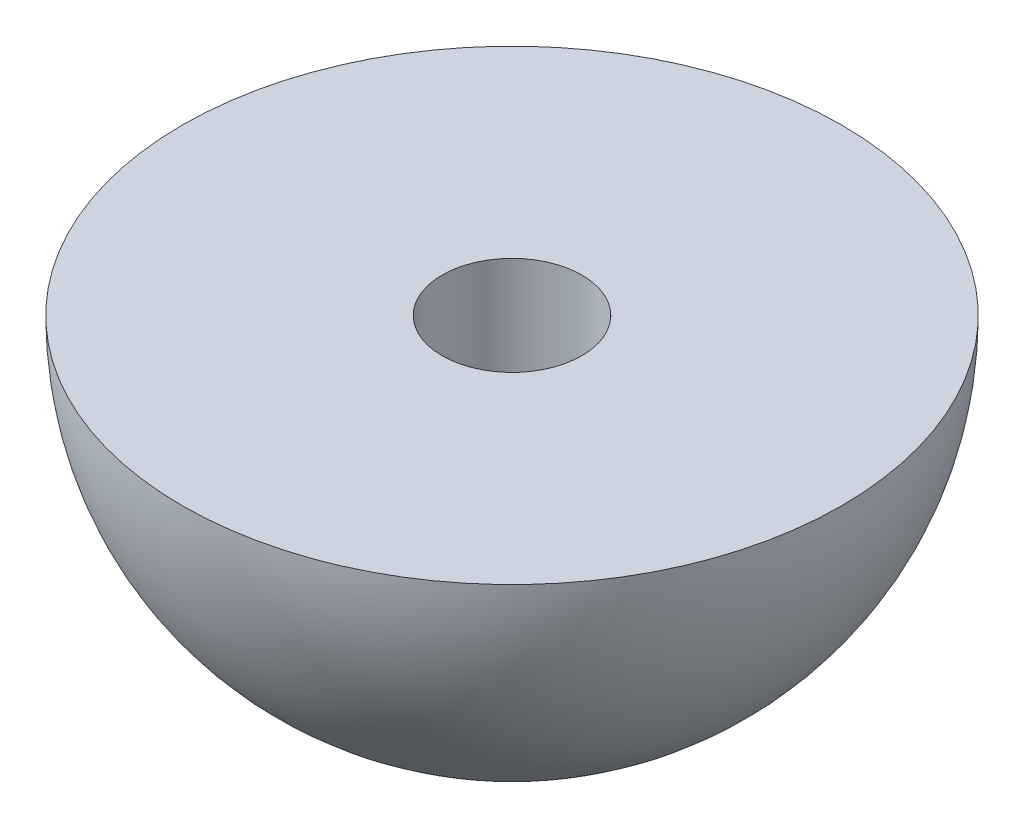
SolidWorks part; units mm, degrees
ref_plane "Front" through (0, 0, 0) normal (0, 0, 1) x (1, 0, 0)
ref_plane "Top" through (0, 0, 0) normal (0, 1, 0) x (1, 0, 0)
ref_plane "Right" through (0, 0, 0) normal (1, 0, 0) x (0, 0, -1)
sketch "Sketch1" plane through (0, 0, 0) normal (0, 0, 1) x (1, 0, 0)
  line L0 (0, 0) -> (0, -9.525)
  line L1 (0, 0) -> (-9.525, 0)
  arc A0 (-9.525, 0) -> (0, -9.525) centre (0, 0) ccw
  dimension "D1" = 19.05
revolve "Revolve1" add sketch "Sketch1" angle 360 about L0
hole_wizard "#10-32 Tapped Hole1" positions "Sketch2" profile "Sketch3" tap size "#10-32" standard "ANSI Inch"
sketch "Sketch2" plane through (0, 0, 0) normal (0, 1, 0) x (1, 0, 0)
  point P0 (0, 0)
sketch "Sketch3" plane through (0, 0, 0) normal (1, 0, 0) x (0, 0, 1)
  line L0 (0, 0) -> (0, 7.8173)
  line L1 (0, 7.8173) -> (2.0193, 6.604)
  line L2 (2.0193, 6.604) -> (2.0193, 0)
  line L5 (2.0193, 0) -> (0, 0)
  line L10 (0, 7.8173) -> (-2.0193, 6.604) construction
  line L11 (0, -6.35) -> (0, 107.95) construction
  dimension "Tap Drill Dia." = 4.0386
  dimension "Tap Drill Depth" = 6.604
  dimension "Drill Angle" = 118
